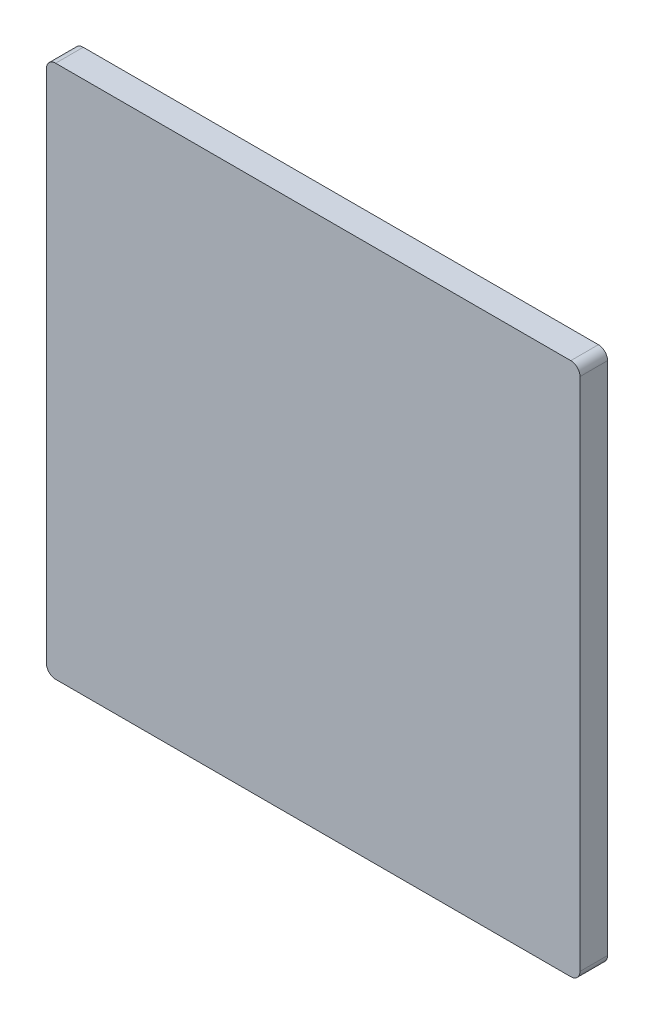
SolidWorks part; units mm, degrees
ref_plane "Front" through (0, 0, 0) normal (0, 0, 1) x (1, 0, 0)
ref_plane "Top" through (0, 0, 0) normal (0, 1, 0) x (1, 0, 0)
ref_plane "Right" through (0, 0, 0) normal (1, 0, 0) x (0, 0, -1)
sketch "Sketch1" plane through (0, 0, 0) normal (0, 0, 1) x (1, 0, 0)
  line L1 (-44.45, 46.0375) -> (44.45, 46.0375)
  line L2 (-46.0375, 44.45) -> (-46.0375, -44.45)
  line L3 (-44.45, -46.0375) -> (44.45, -46.0375)
  line L4 (46.0375, 44.45) -> (46.0375, -44.45)
  arc A0 (-46.0375, 44.45) -> (-44.45, 46.0375) centre (-44.45, 44.45) cw
  arc A1 (46.0375, 44.45) -> (44.45, 46.0375) centre (44.45, 44.45) ccw
  arc A2 (44.45, -46.0375) -> (46.0375, -44.45) centre (44.45, -44.45) ccw
  arc A3 (-46.0375, -44.45) -> (-44.45, -46.0375) centre (-44.45, -44.45) ccw
  point P7 (-46.0375, 46.0375)
  point P12 (46.0375, -46.0375)
  point P15 (-46.0375, -46.0375)
  dimension "D5" = 1.5875
  dimension "D1" = 46.0375
  dimension "D2" = 92.075
  dimension "D3" = 46.0375
  dimension "D4" = 92.075
extrude "Extrude1" add sketch "Sketch1" along normal blind 4.7625
